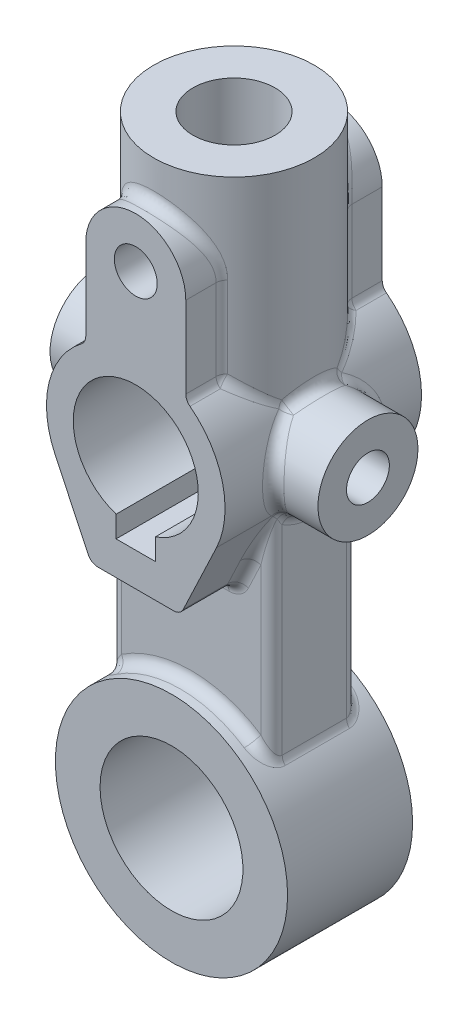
SolidWorks part; units mm, degrees
ref_plane "Front Plane" through (0, 0, 0) normal (0, 0, 1) x (1, 0, 0)
ref_plane "Top Plane" through (0, 0, 0) normal (0, 1, 0) x (1, 0, 0)
ref_plane "Right Plane" through (0, 0, 0) normal (1, 0, 0) x (0, 0, -1)
sketch "Sketch1" plane through (0, 0, 0) normal (0, 0, 1) x (1, 0, 0)
  line L0 (-12.5, -32) -> (-22.5914, -10.7065)
  line L1 (12.5, -32) -> (-12.5, -32)
  line L2 (22.5914, -10.7065) -> (12.5, -32)
  line L3 (0, 0) -> (0, 45) construction
  line L4 (14, 20.7123) -> (14, 45)
  line L5 (-14, 45) -> (-14, 20.7123)
  arc A0 (22.5914, -10.7065) -> (14, 20.7123) centre (0, 0) ccw
  arc A1 (14, 45) -> (-14, 45) centre (0, 45) ccw
  arc A2 (-14, 20.7123) -> (-22.5914, -10.7065) centre (0, 0) ccw
  dimension "D1" = 14
  dimension "D3" = 25
  dimension "D5" = 45
  dimension "D2" = 25
  dimension "D4" = 32
extrude "Boss-Extrude1" add sketch "Sketch1" along normal mid plane 55
sketch "Sketch2" plane through (0, 0, 0) normal (0, 1, 0) x (1, 0, 0)
  circle A0 centre (0, 0) radius 22.5
  dimension "D1" = 45
extrude "Boss-Extrude2" add sketch "Sketch2" along normal blind 70
sketch "Sketch3" plane through (0, 0, 0) normal (0, 1, 0) x (1, 0, 0)
  line L1 (-22.5, 12) -> (22.5, 12)
  line L2 (-22.5, 12) -> (-22.5, -12)
  line L3 (-22.5, -12) -> (22.5, -12)
  line L4 (22.5, 12) -> (22.5, -12)
  line L5 (-22.5, 12) -> (22.5, -12) construction
  line L6 (-22.5, -12) -> (22.5, 12) construction
  arc A0 (14, -17.6139) -> (14, 17.6139) centre (0, 0) ccw construction
  point P0 (0, 0)
  dimension "D1" = 24
extrude "Boss-Extrude3" add sketch "Sketch3" against normal blind 95
sketch "Sketch4" plane through (0, 0, 0) normal (0, 0, 1) x (1, 0, 0)
  line L0 (-22.5, -95) -> (22.5, -95) construction
  circle A0 centre (0, -95) radius 32.5
  dimension "D1" = 65
extrude "Boss-Extrude4" add sketch "Sketch4" along normal mid plane 35
sketch "Sketch5" plane through (0, 0, 0) normal (1, 0, 0) x (0, 0, -1)
  circle A0 centre (0, 0) radius 14
  dimension "D1" = 28
extrude "Boss-Extrude5" add sketch "Sketch5" along normal mid plane 75
sketch "Sketch6" plane through (0, 0, 27.5) normal (0, 0, 1) x (1, 0, 0)
  line L0 (0, 0) -> (0, -22.6132) construction
  line L1 (-5.5, -22.6132) -> (5.5, -22.6132)
  line L2 (5.5, -22.6132) -> (5.5, -16.6132)
  line L3 (-5.5, -22.6132) -> (-5.5, -16.6132)
  arc A0 (5.5, -16.6132) -> (-5.5, -16.6132) centre (0, 0) ccw
  dimension "D3" = 35
  dimension "D1" = 11
  dimension "D2" = 6
extrude "Cut-Extrude1" cut sketch "Sketch6" against normal through all
sketch "Sketch7" plane through (0, 70, 0) normal (0, 1, 0) x (1, 0, 0)
  circle A0 centre (0, 0) radius 11.5
  dimension "D1" = 23
extrude "Cut-Extrude2" cut sketch "Sketch7" against normal up to next
hole_wizard "Ø12.0 (12) Diameter Hole1" positions "Sketch9" profile "Sketch8" hole size "Ø12.0" standard "ANSI Metric"
sketch "Sketch9" plane through (0, 0, 27.5) normal (0, 0, 1) x (1, 0, 0)
  point P0 (0, 45)
sketch "Sketch8" plane through (0, 45, 27.5) normal (1, 0, 0) x (0, -1, 0)
  line L0 (0, 0) -> (0, 55)
  line L1 (0, 55) -> (6, 55)
  line L2 (6, 55) -> (6, 0)
  line L5 (6, 0) -> (0, 0)
  line L11 (0, -6.35) -> (0, 107.95) construction
  dimension "Thru Hole Dia." = 12
  dimension "Thru Hole Depth" = 55
hole_wizard "Ø12.0 (12) Diameter Hole2" positions "Sketch11" profile "Sketch10" hole size "Ø12.0" standard "ANSI Metric"
sketch "Sketch11" plane through (-37.5, 0, 0) normal (-1, 0, 0) x (0, 0, 1)
  point P0 (0, 0)
sketch "Sketch10" plane through (-37.5, 0, 0) normal (0, 1, 0) x (0, 0, 1)
  line L0 (0, 0) -> (0, 75)
  line L1 (0, 75) -> (6, 75)
  line L2 (6, 75) -> (6, 0)
  line L5 (6, 0) -> (0, 0)
  line L11 (0, -6.35) -> (0, 107.95) construction
  dimension "Thru Hole Dia." = 12
  dimension "Thru Hole Depth" = 75
sketch "Sketch12" plane through (0, 0, -17.5) normal (0, 0, -1) x (-1, 0, 0)
  circle A0 centre (0, -95) radius 20
  dimension "D1" = 40
extrude "Cut-Extrude3" cut sketch "Sketch12" against normal through all
fillet "Fillet1" radius 3 4 edges at (-22.5, -41.2236, -12) (-22.5, -41.2236, 12) (22.5, -41.2236, -12) (22.5, -41.2236, 12)
fillet "Fillet2" radius 3 16 edges at (-21.741, -70.8426, 10.9945) (-22.5, -71.5479, 0) (-22.0944, -71.1654, -10.5064) (0, -62.5, -12) (21.741, -70.8426, -10.9945) (22.5, -71.5479, 0) (22.0944, -71.1654, 10.5064) (-24.9996, -0.1361, -13.9993) (-24.9996, -0.1361, -13.9993) (-22.5, -14, 0) (-22.496, 13.9935, -0.425) (22.4928, 13.9884, -0.5692) (24.9996, 0.1361, -13.9993) (24.9996, 0.1361, -13.9993) (22.5, -14, 0) (0, -62.5, 12)
fillet "Fillet3" radius 3 8 edges at (14, 20.7123, 22.557) (-14, 20.7123, 22.557) (14, 20.7123, -22.557) (-14, 20.7123, -22.557) (-12.5, -32, -19.75) (12.5, -32, -19.75) (12.5, -32, 19.75) (-12.5, -32, 19.75)
fillet "Fillet4" radius 3 36 edges at (-23.35, -10.737, 9.6485) (-16.4064, -23.7572, 12) (-16.4064, -23.7572, -12) (-23.35, -10.737, -9.6485) (-22.5994, 12.2121, 7.3945) (22.6028, 12.2108, 7.3938) (14.4347, 20.6932, 17.2595) (14, 33.6243, 17.6139) (0.5692, 58.9884, -22.4928) (0.5692, 31.0116, 22.4928) (-14, 33.6243, 17.6139) (-14.156, 21.2938, 17.4888) (22.6054, 12.2098, -7.3932) (14.156, 21.2938, -17.4888) (14, 33.6243, -17.6139) (-14, 33.6243, -17.6139) (-14.4347, 20.6932, -17.2595) (-22.6063, 12.2095, -7.393) (-20.9175, -14.2385, 11.644) (-20.9175, -14.2385, -11.644) (23.35, -10.737, 9.6485) (20.9175, -14.2385, 11.644) (16.4064, -23.7572, 12) (12.2059, -31.5352, 12) (0, -32, 12) (-12.2059, -31.5352, 12) (23.35, -10.737, -9.6485) (20.9175, -14.2385, -11.644) (16.4064, -23.7572, -12) (12.2059, -31.5352, -12) (0, -32, -12) (-12.2059, -31.5352, -12)
